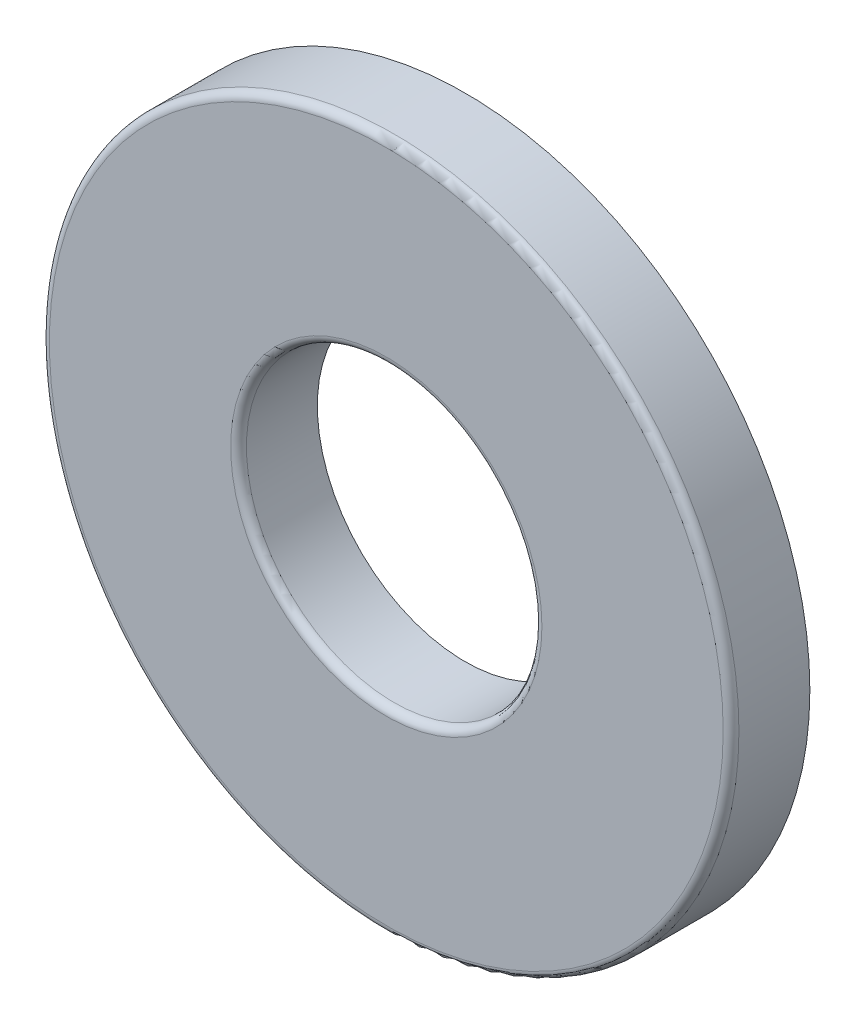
SolidWorks part; units mm, degrees
ref_plane "Front Plane" through (0, 0, 0) normal (0, 0, 1) x (1, 0, 0)
ref_plane "Top Plane" through (0, 0, 0) normal (0, 1, 0) x (1, 0, 0)
ref_plane "Right Plane" through (0, 0, 0) normal (1, 0, 0) x (0, 0, -1)
sketch "Sketch1" plane through (0, 0, 0) normal (0, 0, 1) x (1, 0, 0)
  line L0 (0, 0) -> (4.7625, 0) construction
  line L1 (0, -0.943) -> (0, 0.943) construction
  circle A0 centre (0, 0) radius 11.1125
  circle A1 centre (0, 0) radius 4.7625
  dimension "D1" = 90
  dimension "OD" = 22.225
  dimension "ID" = 9.525
sketch "Sketch2" plane through (0, 0, 0) normal (1, 0, 0) x (0, 0, -1)
  line L0 (-1.27, 11.1125) -> (1.27, 11.1125) construction
  point P5 (0, 11.1125)
sketch "Sketch3" plane through (0, 0, 0) normal (0, 0, 1) x (1, 0, 0)
  circle A0 centre (0, 0) radius 4.7625 construction
  circle A1 centre (0, 0) radius 11.1125 construction
  circle A2 centre (0, 0) radius 4.7625
  circle A3 centre (0, 0) radius 11.1125
extrude "Boss-Extrude1" add sketch "Sketch3" against normal up to vertex (1.27 mm away) from vertex at 1.27
fillet "Fillet1" radius 0.254 2 edges at (11.1125, 0, 1.27) (4.7625, 0, 1.27)
equation "\"D1@Fillet1\"=\"Thickness@Sketch2\"/10"
